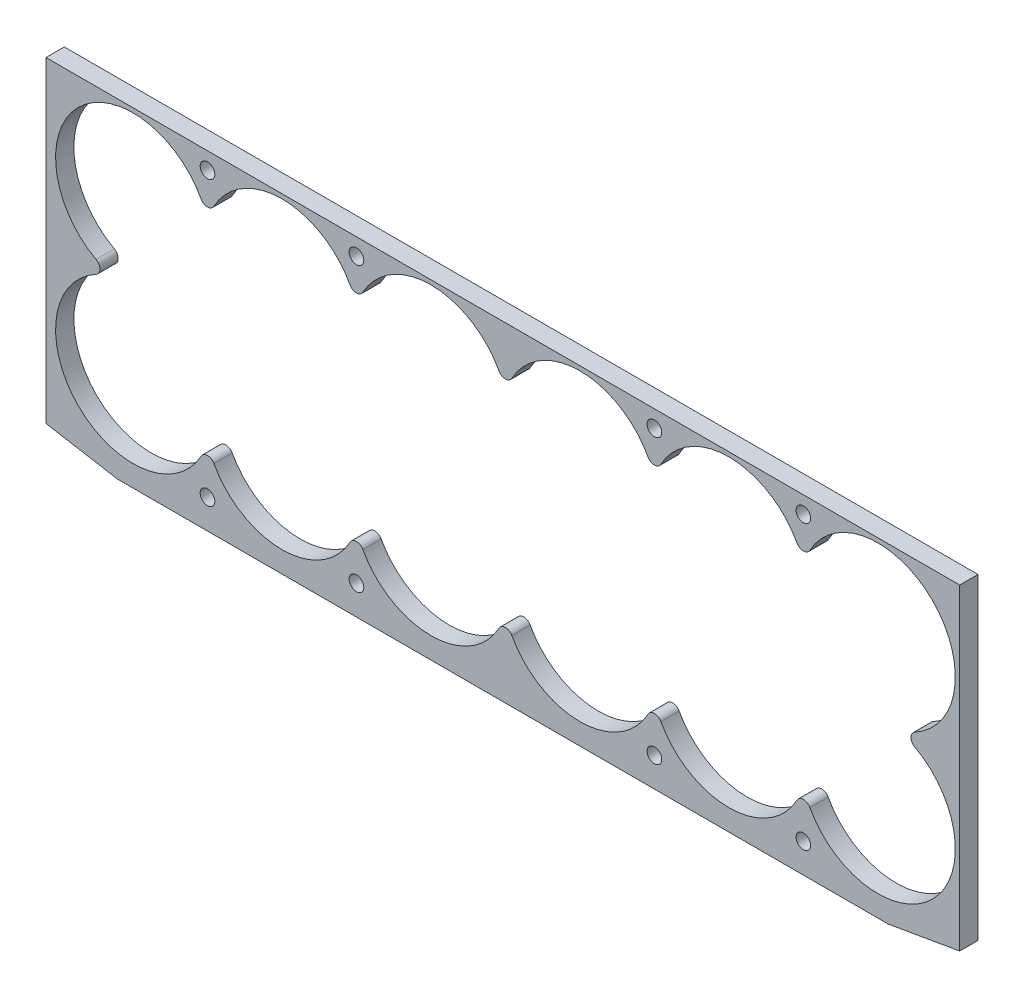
SolidWorks part; units mm, degrees
ref_plane "Front Plane" through (0, 0, 0) normal (0, 0, 1) x (1, 0, 0)
ref_plane "Top Plane" through (0, 0, 0) normal (0, 1, 0) x (1, 0, 0)
ref_plane "Right Plane" through (0, 0, 0) normal (1, 0, 0) x (0, 0, -1)
sketch "Sketch1" plane through (0, 0, 0) normal (0, 0, 1) x (1, 0, 0)
  line L0 (1.27, 1.27) -> (1.27, -53.7326)
  line L1 (1.27, -53.7326) -> (-11.1577, -55.88)
  line L2 (-11.1577, -55.88) -> (-144.8423, -55.88)
  line L3 (-144.8423, -55.88) -> (-157.27, -53.7326)
  line L4 (-157.27, -53.7326) -> (-157.27, 1.27)
  line L5 (-157.27, 1.27) -> (1.27, 1.27)
  circle A0 centre (-25.85, -50.8) radius 1.27
  circle A1 centre (-51.7, -50.8) radius 1.27
  circle A2 centre (-103.4, -50.8) radius 1.27
  circle A3 centre (-129.25, -50.8) radius 1.27
  circle A8 centre (-25.85, -1.6626) radius 1.27
  circle A9 centre (-51.7, -1.6626) radius 1.27
  circle A10 centre (-103.4, -1.6626) radius 1.27
  circle A11 centre (-129.25, -1.6626) radius 1.27
  arc A12 (-25.85, -42.4342) -> (-9.2658, -25.85) centre (-12.925, -38.775) ccw
  arc A13 (-51.7, -42.4342) -> (-25.85, -42.4342) centre (-38.775, -38.775) ccw
  arc A14 (-77.55, -42.4342) -> (-51.7, -42.4342) centre (-64.625, -38.775) ccw
  arc A15 (-103.4, -42.4342) -> (-77.55, -42.4342) centre (-90.475, -38.775) ccw
  arc A16 (-129.25, -42.4342) -> (-103.4, -42.4342) centre (-116.325, -38.775) ccw
  arc A17 (-145.8342, -25.85) -> (-129.25, -42.4342) centre (-142.175, -38.775) ccw
  arc A18 (-129.25, -9.2658) -> (-145.8342, -25.85) centre (-142.175, -12.925) ccw
  arc A19 (-103.4, -9.2658) -> (-129.25, -9.2658) centre (-116.325, -12.925) ccw
  arc A20 (-77.55, -9.2658) -> (-103.4, -9.2658) centre (-90.475, -12.925) ccw
  arc A21 (-25.85, -9.2658) -> (-51.7, -9.2658) centre (-38.775, -12.925) ccw
  arc A22 (-51.7, -9.2658) -> (-77.55, -9.2658) centre (-64.625, -12.925) ccw
  arc A23 (-9.2658, -25.85) -> (-25.85, -9.2658) centre (-12.925, -12.925) ccw
  arc A24 (-148.5784, -26.9664) -> (-155.608, -38.775) centre (-142.175, -38.775) ccw construction
  arc A25 (-128.1336, -45.1784) -> (-104.5164, -45.1784) centre (-116.325, -38.775) ccw construction
  arc A26 (-102.2836, -45.1784) -> (-78.6664, -45.1784) centre (-90.475, -38.775) ccw construction
  arc A27 (-76.4336, -45.1784) -> (-52.8164, -45.1784) centre (-64.625, -38.775) ccw construction
  arc A28 (-50.5836, -45.1784) -> (-26.9664, -45.1784) centre (-38.775, -38.775) ccw construction
  arc A29 (-26.9664, -6.5216) -> (-35.1158, 0) centre (-38.775, -12.925) ccw construction
  arc A30 (-52.8164, -6.5216) -> (-60.9658, 0) centre (-64.625, -12.925) ccw construction
  arc A31 (-78.6664, -6.5216) -> (-86.8158, 0) centre (-90.475, -12.925) ccw construction
  arc A32 (-104.5164, -6.5216) -> (-112.6658, 0) centre (-116.325, -12.925) ccw construction
  arc A33 (-130.3664, -6.5216) -> (-138.5158, 0) centre (-142.175, -12.925) ccw construction
  arc A34 (-16.5842, 0) -> (-24.7336, -6.5216) centre (-12.925, -12.925) ccw construction
  dimension "D1" = 2.54
extrude "Boss-Extrude1" add sketch "Sketch1" along normal blind 3.175
sketch "Sketch2" plane through (0, 0, 3.175) normal (0, 0, 1) x (1, 0, 0)
  line L0 (1.27, -53.7326) -> (-11.1577, -55.88)
  line L1 (-11.1577, -55.88) -> (-144.8423, -55.88)
  line L2 (-144.8423, -55.88) -> (-157.27, -53.7326)
  line L3 (-157.27, -53.7326) -> (-157.27, 1.27)
  line L4 (-157.27, 1.27) -> (1.27, 1.27)
  line L5 (1.27, 1.27) -> (1.27, -53.7326)
  circle A0 centre (-25.85, -50.8) radius 1.27
  circle A1 centre (-51.7, -50.8) radius 1.27
  circle A2 centre (-103.4, -50.8) radius 1.27
  circle A3 centre (-129.25, -50.8) radius 1.27
  circle A4 centre (-103.4, -1.6626) radius 1.27
  circle A5 centre (-129.25, -1.6626) radius 1.27
  circle A6 centre (-51.7, -1.6626) radius 1.27
  circle A7 centre (-25.85, -1.6626) radius 1.27
  circle A8 centre (-25.85, -1.6626) radius 1.27 construction
fillet "Fillet1" radius 1.27 12 edges at (-9.2658, -25.85, 1.5875) (-25.85, -9.2658, 1.5875) (-51.7, -9.2658, 1.5875) (-77.55, -9.2658, 1.5875) (-103.4, -9.2658, 1.5875) (-129.25, -9.2658, 1.5875) (-145.8342, -25.85, 1.5875) (-129.25, -42.4342, 1.5875) (-103.4, -42.4342, 1.5875) (-77.55, -42.4342, 1.5875) (-51.7, -42.4342, 1.5875) (-25.85, -42.4342, 1.5875)
